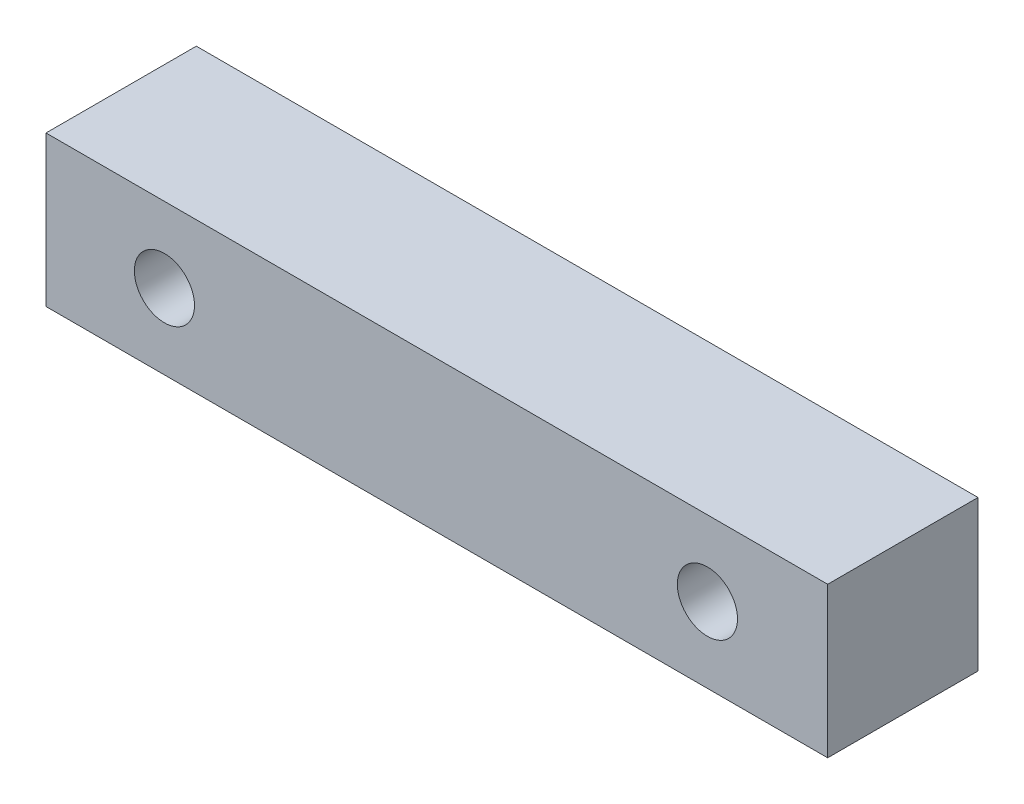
SolidWorks part; units mm, degrees
ref_plane "Front Plane" through (0, 0, 0) normal (0, 0, 1) x (1, 0, 0)
ref_plane "Top Plane" through (0, 0, 0) normal (0, 1, 0) x (1, 0, 0)
ref_plane "Right Plane" through (0, 0, 0) normal (1, 0, 0) x (0, 0, -1)
sketch "Sketch1" plane through (0, 0, 0) normal (0, 0, 1) x (1, 0, 0)
  line L1 (-13, 2.5) -> (13, 2.5)
  line L2 (-13, 2.5) -> (-13, -2.5)
  line L3 (-13, -2.5) -> (13, -2.5)
  line L4 (13, 2.5) -> (13, -2.5)
extrude "Boss-Extrude1" add sketch "Sketch1" along normal blind 5
sketch "Sketch2" plane through (0, 0, 5) normal (0, 0, 1) x (1, 0, 0)
  line L0 (13, -2.5) -> (13, 2.5) construction
  circle A0 centre (-9.0609, 0) radius 1
  circle A1 centre (9, 0) radius 1
  point P4 (13, 0)
  dimension "D1" = 18.0609
  dimension "D2" = 4
extrude "Cut-Extrude1" cut sketch "Sketch2" against normal blind 5
